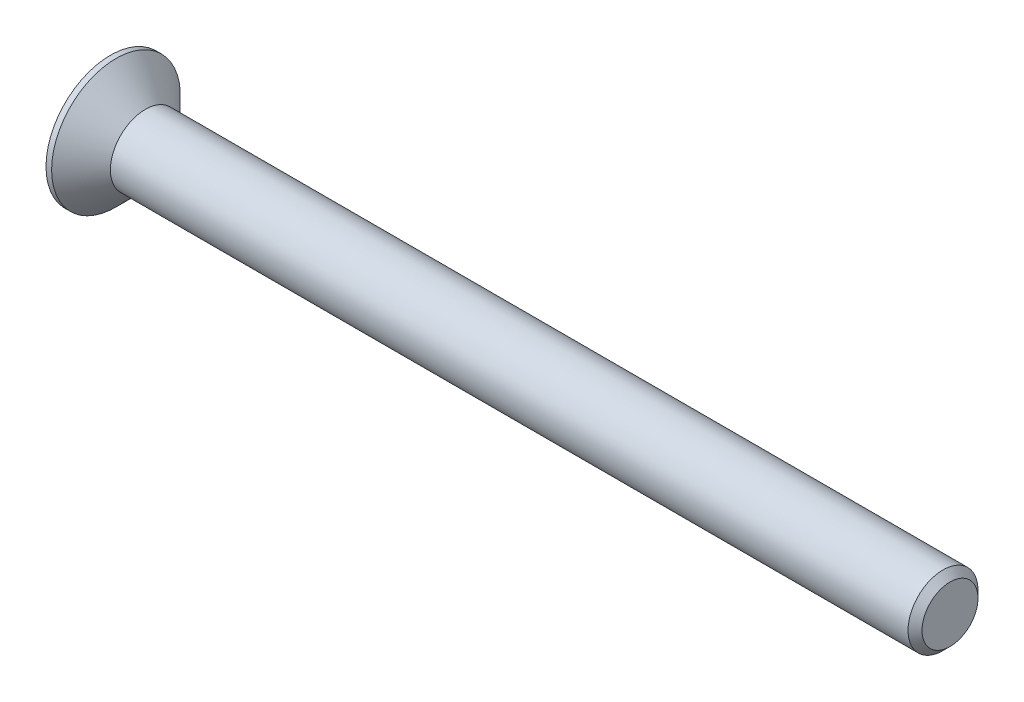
SolidWorks part; units mm, degrees
ref_plane "Front Plane" through (0, 0, 0) normal (0, 0, 1) x (1, 0, 0)
ref_plane "Top Plane" through (0, 0, 0) normal (0, 1, 0) x (1, 0, 0)
ref_plane "Right Plane" through (0, 0, 0) normal (1, 0, 0) x (0, 0, -1)
sketch "Sketch1" plane through (0, 0, 0) normal (0, 0, 1) x (1, 0, 0)
  line L1 (-2.5, 4.6) -> (-2.5, 0)
  line L2 (-2.5, 0) -> (57.5, 0)
  line L3 (57.5, 0) -> (57.5, 2.5)
  line L4 (57.5, 2.5) -> (0, 2.5)
  line L5 (-2.5, 4.6) -> (-2.1, 4.6)
  line L6 (-2.1, 4.6) -> (0, 2.5)
  dimension "D1" = 2.5
  dimension "D2" = 45
  dimension "D3" = 2.5
  dimension "D4" = 60
  dimension "D5" = 4.6
revolve "Revolve1" add sketch "Sketch1" angle 360 about L2
chamfer "Chamfer1" distance 0.5 angle 45 1 edges at (57.5, 0, 2.5)
sketch "Sketch2" plane through (-2.5, 0, 0) normal (-1, 0, 0) x (0, 0, 1)
  line L0 (-0.575, 2.3) -> (0.575, 2.3)
  line L1 (0.575, 2.3) -> (0.575, 0.575)
  line L2 (0.575, 0.575) -> (2.3, 0.575)
  line L3 (2.3, 0.575) -> (2.3, -0.575)
  line L4 (2.3, -0.575) -> (0.575, -0.575)
  line L5 (0.575, -0.575) -> (0.575, -2.3)
  line L6 (0.575, -2.3) -> (-0.575, -2.3)
  line L7 (-0.575, -2.3) -> (-0.575, -0.575)
  line L8 (-0.575, -0.575) -> (-2.3, -0.575)
  line L9 (-2.3, -0.575) -> (-2.3, 0.575)
  line L10 (-2.3, 0.575) -> (-0.575, 0.575)
  line L11 (-0.575, 0.575) -> (-0.575, 2.3)
  point P2 (0, 2.3)
  point P14 (0, -2.3)
  point P15 (2.3, 0)
  point P16 (-2.3, 0)
  dimension "D1" = 4.6
  dimension "D2" = 1.15
extrude "Cut-Extrude1" cut sketch "Sketch2" against normal blind 2.1
